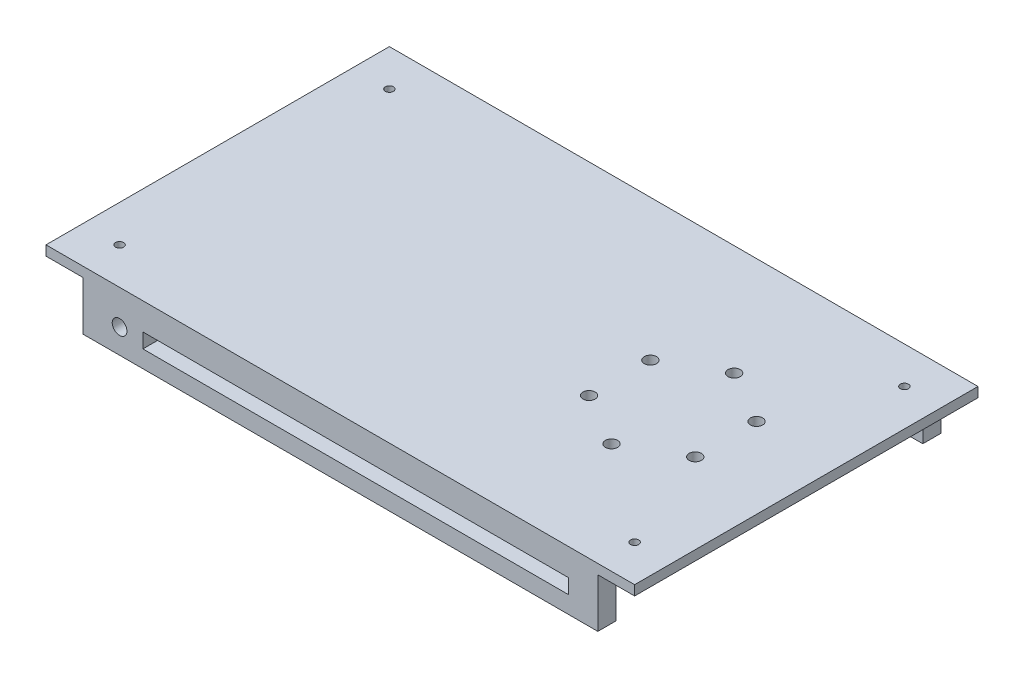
SolidWorks part; units mm, degrees
ref_plane "前视基准面" through (0, 0, 0) normal (0, 0, 1) x (1, 0, 0)
ref_plane "上视基准面" through (0, 0, 0) normal (0, 1, 0) x (1, 0, 0)
ref_plane "右视基准面" through (0, 0, 0) normal (1, 0, 0) x (0, 0, -1)
other "Configuration Table"
sketch "草图1" plane through (0, 0, 0) normal (0, 0, 1) x (1, 0, 0)
  line L1 (-240, 0) -> (240, 0)
  line L2 (-240, 0) -> (-240, 8)
  line L3 (-240, 8) -> (240, 8)
  line L4 (240, 0) -> (240, 8)
  line L5 (-240, 0) -> (240, 8) construction
  line L6 (-240, 8) -> (240, 0) construction
  point P0 (0, 4)
  dimension "D1" = 240
  dimension "D2" = 4
extrude "Payload_Deck_480x280x8" add sketch "草图1" against normal mid plane 280
sketch "草图2" plane through (0, 0, 0) normal (0, 0, 1) x (1, 0, 0)
  line L0 (-240, 0) -> (240, 0) construction
  line L1 (-210, -40) -> (210, -40)
  line L2 (-210, -40) -> (-210, 0)
  line L3 (-210, 0) -> (210, 0)
  line L4 (210, -40) -> (210, 0)
  line L5 (-210, -40) -> (210, 0) construction
  line L6 (-210, 0) -> (210, -40) construction
  point P0 (0, -20)
  dimension "D1" = 210
  dimension "D2" = 20
extrude "Guide_Rails_Blank" add sketch "草图2" against normal mid plane 280
sketch "草图3" plane through (0, 0, 0) normal (0, 0, 1) x (1, 0, 0)
  line L0 (210, 0) -> (240, 0) construction
  line L1 (-215, -42) -> (215, -42)
  line L2 (-215, -42) -> (-215, 0)
  line L3 (-215, 0) -> (215, 0)
  line L4 (215, -42) -> (215, 0)
  line L5 (-215, -42) -> (215, 0) construction
  line L6 (-215, 0) -> (215, -42) construction
  point P0 (0, -21)
  dimension "D1" = 215
  dimension "D2" = 21
extrude "Open_Centre_Under_Deck" cut sketch "草图3" against normal mid plane 250
sketch "草图4" plane through (0, 0, 0) normal (0, 0, 1) x (1, 0, 0)
  circle A0 centre (-180, -20) radius 6
  dimension "D1" = 12
  dimension "D2" = 180
  dimension "D3" = 20
extrude "Fixed_Pivot_D12_Xminus180" cut sketch "草图4" against normal mid plane 1000
sketch "草图5" plane through (0, 0, 0) normal (0, 0, 1) x (1, 0, 0)
  line L1 (-161, -26) -> (186, -26)
  line L2 (-161, -26) -> (-161, -14)
  line L3 (-161, -14) -> (186, -14)
  line L4 (186, -26) -> (186, -14)
  line L5 (-161, -26) -> (186, -14) construction
  line L6 (-161, -14) -> (186, -26) construction
  point P0 (12.5, -20)
  dimension "D1" = 12.5
  dimension "D2" = 186
  dimension "D3" = 14
  dimension "D4" = 20
extrude "Sliding_Guide_12x347" cut sketch "草图5" against normal mid plane 1000
sketch "草图6" plane through (0, 0, 0) normal (0, 1, 0) x (1, 0, 0)
  circle A0 centre (-210, -110) radius 3.3
  circle A1 centre (-210, 110) radius 3.3
  circle A2 centre (210, -110) radius 3.3
  circle A3 centre (210, 110) radius 3.3
  dimension "D1" = 6.6
  dimension "D2" = 210
  dimension "D3" = 210
  dimension "D4" = 110
  dimension "D5" = 110
extrude "Four_M6_Clearance_D6p6_420x220" cut sketch "草图6" against normal mid plane 100
sketch "草图7" plane through (0, 0, 0) normal (0, 1, 0) x (1, 0, 0)
  circle A0 centre (174.4476, -25) radius 5
  circle A1 centre (131.1463, 50) radius 5
  circle A2 centre (87.8451, 25) radius 5
  circle A3 centre (87.8451, -25) radius 5
  dimension "D1" = 10
  dimension "D2" = 87.8451
  dimension "D3" = 131.1463
  dimension "D4" = 174.4476
  dimension "D5" = 25
  dimension "D6" = 50
  dimension "D7" = 25
extrude "Match_Original_Arm_Flange_Holes" cut sketch "草图7" against normal mid plane 100
sketch "草图8" plane through (0, 0, 0) normal (0, 1, 0) x (1, 0, 0)
  circle A0 centre (174.4476, 25) radius 5
  circle A1 centre (131.1463, -50) radius 5
  dimension "D1" = 10
  dimension "D2" = 131.1463
  dimension "D3" = 174.4476
  dimension "D4" = 25
  dimension "D5" = 50
extrude "Complete_Original_6xD10_Flange" cut sketch "草图8" against normal mid plane 100
